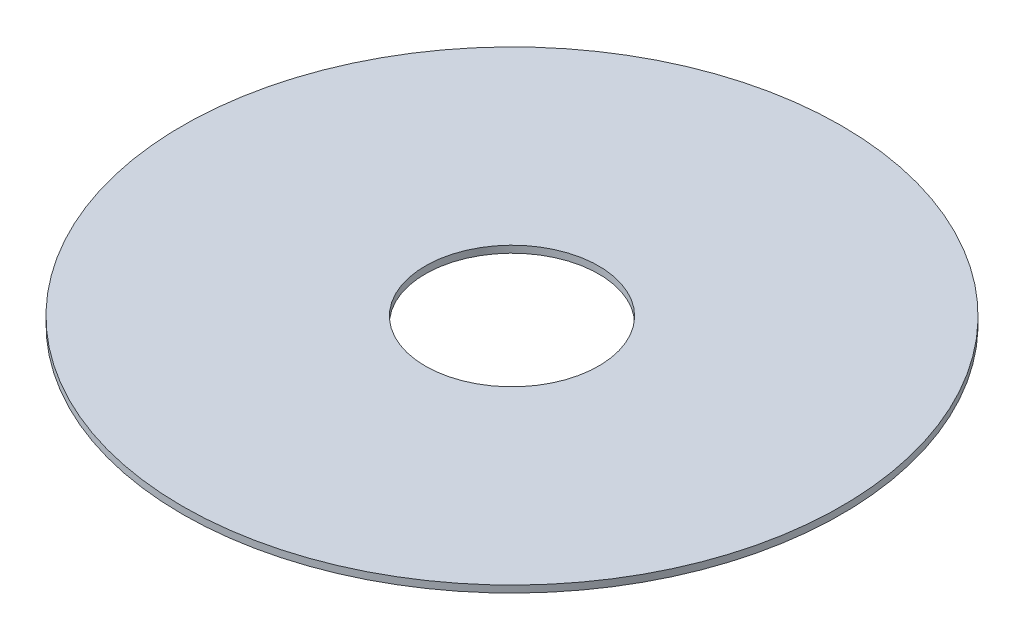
SolidWorks part; units mm, degrees
ref_plane "Front Plane" through (0, 0, 0) normal (0, 0, 1) x (1, 0, 0)
ref_plane "Top Plane" through (0, 0, 0) normal (0, 1, 0) x (1, 0, 0)
ref_plane "Right Plane" through (0, 0, 0) normal (1, 0, 0) x (0, 0, -1)
sketch "Sketch1" plane through (0, 0, 0) normal (0, 1, 0) x (1, 0, 0)
  circle A0 centre (0, 0) radius 47.5
  dimension "D1" = 95
extrude "Boss-Extrude1" add sketch "Sketch1" along normal blind 1 contours A0
sketch "Sketch2" plane through (0, 1, 0) normal (0, 1, 0) x (1, 0, 0)
  circle A0 centre (0, 0) radius 12.5
  dimension "D1" = 25
extrude "Cut-Extrude1" cut sketch "Sketch2" against normal blind 1
